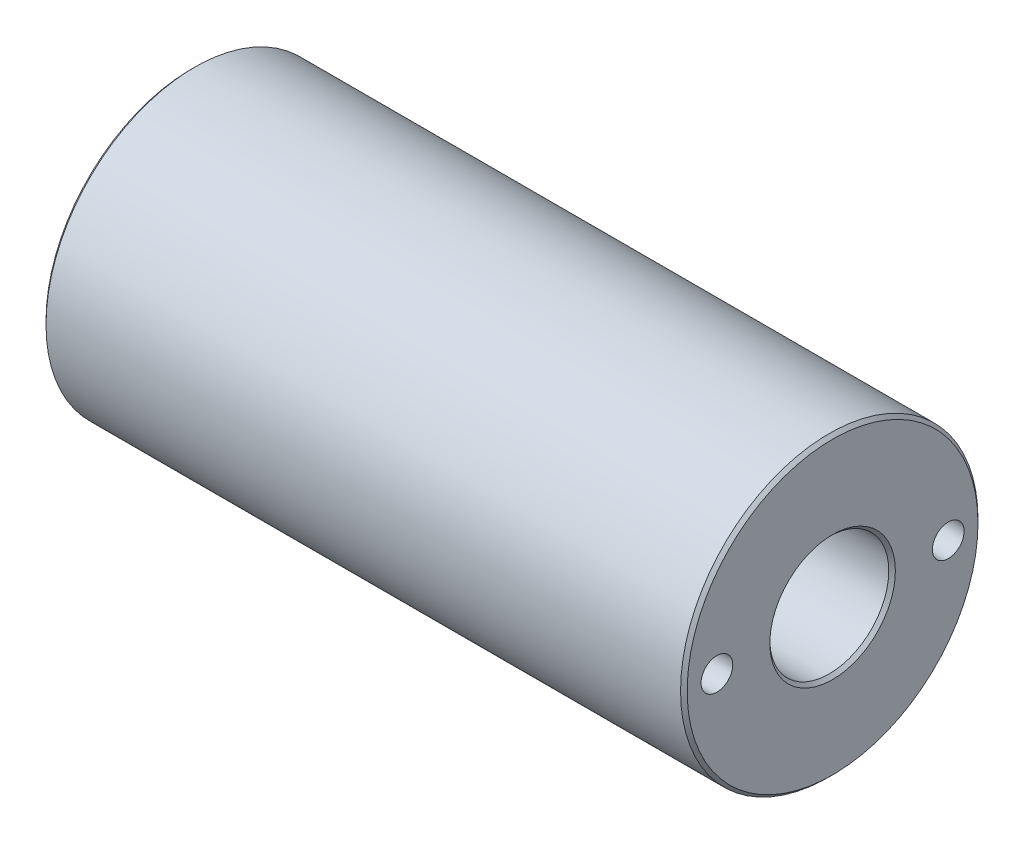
SolidWorks part; units mm, degrees
ref_plane "Face" through (0, 0, 0) normal (0, 0, 1) x (1, 0, 0)
ref_plane "Dessus" through (0, 0, 0) normal (0, 1, 0) x (1, 0, 0)
ref_plane "Droite" through (0, 0, 0) normal (1, 0, 0) x (0, 0, -1)
sketch "Esquisse1" plane through (0, 0, 0) normal (0, 0, 1) x (1, 0, 0)
  line L0 (-97, 22.5) -> (0, 22.5)
  line L1 (0, 22.5) -> (0, 7)
  line L2 (0, 7) -> (-97, 7)
  line L3 (-97, 7) -> (-97, 22.5)
  line L4 (446.5374, 0) -> (-433.1191, 0) construction
  dimension "D1" = 97
  dimension "D2" = 22.5
  dimension "D3" = 7
revolve "Révolution1" add sketch "Esquisse1" angle 360 about L4
chamfer "Chanfrein1" distance 0.5 angle 45
hole_wizard "Trou taraudé M6x1.01" positions "Esquisse5" profile "Esquisse4" tap size "M6x1.0" standard "ISO"
sketch "Esquisse5" plane through (0, 0, 0) normal (1, 0, 0) x (0, 0, -1)
  line L0 (28.0253, 0) -> (-25.5124, 0) construction
  point P0 (-17.5, 0)
  point P1 (17.5, 0)
  dimension "D1" = 35
  dimension "D2" = 17.5
sketch "Esquisse4" plane through (0, 0, 17.5) normal (0, 1, 0) x (0, 0, -1)
  line L0 (0, 0) -> (0, 24.4421)
  line L1 (0, 24.4421) -> (2.4, 23)
  line L2 (2.4, 23) -> (2.4, 0)
  line L5 (2.4, 0) -> (0, 0)
  line L10 (0, 24.4421) -> (-2.4, 23) construction
  line L11 (0, -6.35) -> (0, 107.95) construction
  dimension "Diamètre du trou pour taraudage" = 4.8
  dimension "Profondeur du trou pour taraudage" = 23
  dimension "Angle de pointe" = 118
sketch "Esquisse6" plane through (0, 0, 0) normal (1, 0, 0) x (0, 0, -1)
  circle A0 centre (0, 0) radius 9
  dimension "D1" = 18
extrude "Enlèv. mat.-Extru.1" cut sketch "Esquisse6" against normal blind 17
sketch "Esquisse7" plane through (-97, 0, 0) normal (-1, 0, 0) x (0, 0, 1)
  circle A0 centre (0, 0) radius 9 construction
  circle A1 centre (0, 0) radius 9
extrude "Enlèv. mat.-Extru.2" cut sketch "Esquisse7" against normal blind 17
chamfer "Chanfrein2" distance 0.5 angle 45
